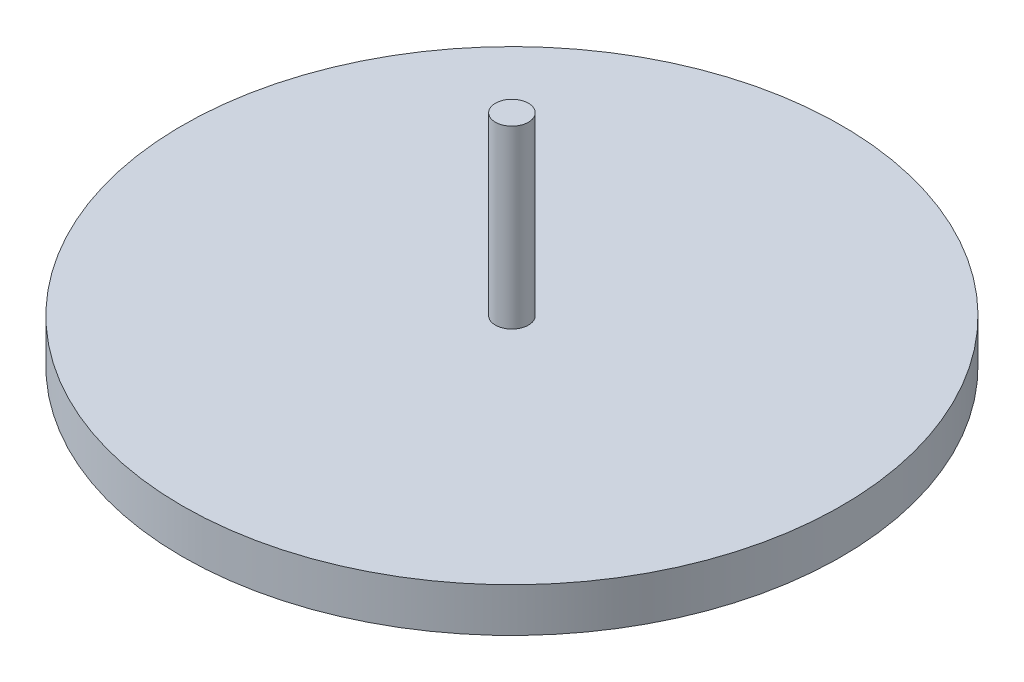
SolidWorks part; units mm, degrees
ref_plane "Alzado" through (0, 0, 0) normal (0, 0, 1) x (1, 0, 0)
ref_plane "Planta" through (0, 0, 0) normal (0, 1, 0) x (1, 0, 0)
ref_plane "Vista lateral" through (0, 0, 0) normal (1, 0, 0) x (0, 0, -1)
sketch "Croquis1" plane through (0, 0, 0) normal (0, 1, 0) x (1, 0, 0)
  circle A0 centre (0, 0) radius 150
  dimension "D1" = 300
extrude "Saliente-Extruir1" add sketch "Croquis1" along normal blind 20
sketch "Croquis2" plane through (0, 20, 0) normal (0, 1, 0) x (1, 0, 0)
  circle A0 centre (0, 0) radius 7.5
  dimension "D1" = 15
extrude "Saliente-Extruir2" add sketch "Croquis2" along normal blind 80 separate body
